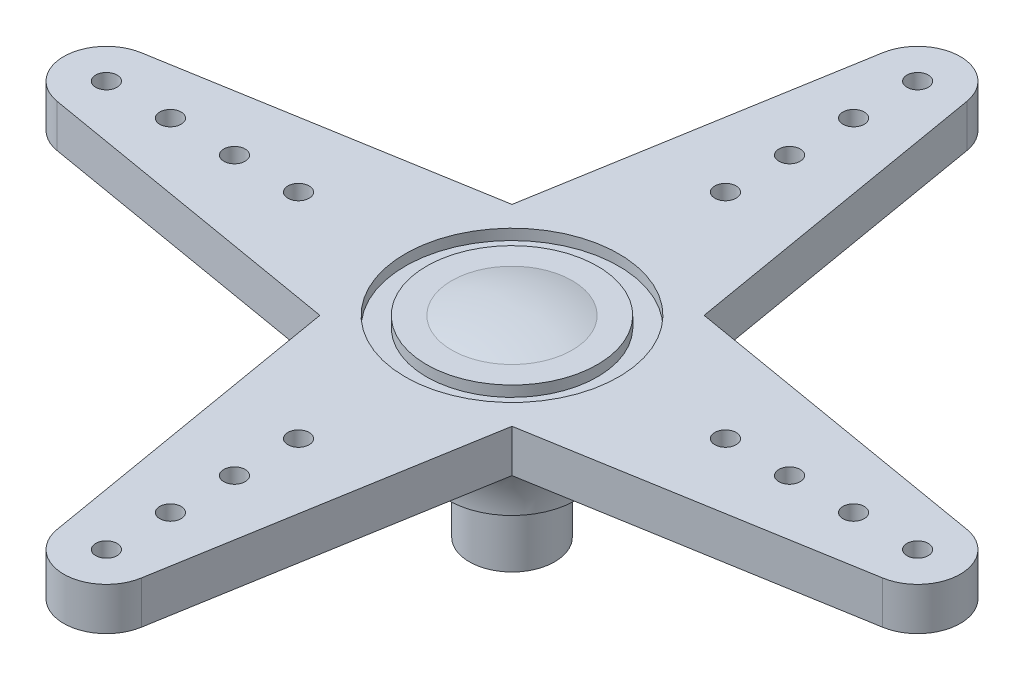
SolidWorks part; units mm, degrees
ref_plane "Plan de face" through (0, 0, 0) normal (0, 0, 1) x (1, 0, 0)
ref_plane "Plan de dessus" through (0, 0, 0) normal (0, 1, 0) x (1, 0, 0)
ref_plane "Plan de droite" through (0, 0, 0) normal (1, 0, 0) x (0, 0, -1)
sketch "Esquisse1" plane through (0, 0, 0) normal (0, 0, 1) x (1, 0, 0)
  line L0 (0, 0) -> (0, 51.3861) construction
  line L1 (0, 0) -> (-2, 0)
  line L2 (-2, 0) -> (-2, 3)
  line L3 (-2, 3) -> (-3, 3)
  line L4 (-4, 6) -> (-4, 7)
  line L5 (-4, 7) -> (0, 7)
  line L6 (0, 7) -> (0, 0)
  arc A0 (-3, 3) -> (-4, 6) centre (-8, 3) ccw
  dimension "D1" = 2
  dimension "D2" = 3
  dimension "D3" = 1
  dimension "D4" = 3
  dimension "D5" = 4
  dimension "D6" = 1
revolve "Révolution1" add sketch "Esquisse1" angle 360 about L0
sketch "Esquisse2" plane through (0, 7, 0) normal (0, 1, 0) x (-1, 0, 0)
  line L0 (0, 0) -> (-4.5, -4.5)
  line L1 (0, 0) -> (-4.5, 4.5)
  line L2 (-4.5, 4.5) -> (-19.336, 1.9716)
  line L3 (-4.5, -4.5) -> (-19.336, -1.9716)
  line L4 (0, 4.4) -> (0, -4.4) construction
  arc A0 (-19.336, -1.9716) -> (-19.336, 1.9716) centre (-19, 0) cw
  circle A1 centre (-19, 0) radius 0.5
  circle A2 centre (-16, 0) radius 0.5
  circle A3 centre (-13, 0) radius 0.5
  circle A4 centre (-10, 0) radius 0.5
  dimension "D4" = 2
  dimension "D6" = 1
  dimension "D1" = 90
  dimension "D2" = 45
  dimension "D3" = 19
  dimension "D5" = 9
extrude "Extrusion1" add sketch "Esquisse2" along normal blind 2
pattern_circular "Répétition circulaire1" count 4 every 90 about axis through (0, 0, 0) along (0, 1, 0) of "Extrusion1"
sketch "Esquisse3" plane through (0, 9, 0) normal (0, 1, 0) x (-1, 0, 0)
  circle A0 centre (0, 0) radius 5
  circle A1 centre (0, 0) radius 4
  dimension "D1" = 10
  dimension "D2" = 8
extrude "Enlèv. mat.-Extru.1" cut sketch "Esquisse3" against normal blind 0.5
sketch "Esquisse4" plane through (0, 0, 0) normal (0, 0, 1) x (1, 0, 0)
  line L0 (0, -26.7123) -> (0, 15.1274) construction
  line L1 (-4.5, 9) -> (-1.9716, 9) construction
  line L2 (-2.8217, 9) -> (0, 9)
  line L3 (0, 9) -> (0, 9.3985)
  arc A0 (0, 9.3985) -> (-2.8217, 9) centre (0, -0.7905) ccw
revolve "Révolution2" add sketch "Esquisse4" angle 360 about L0
